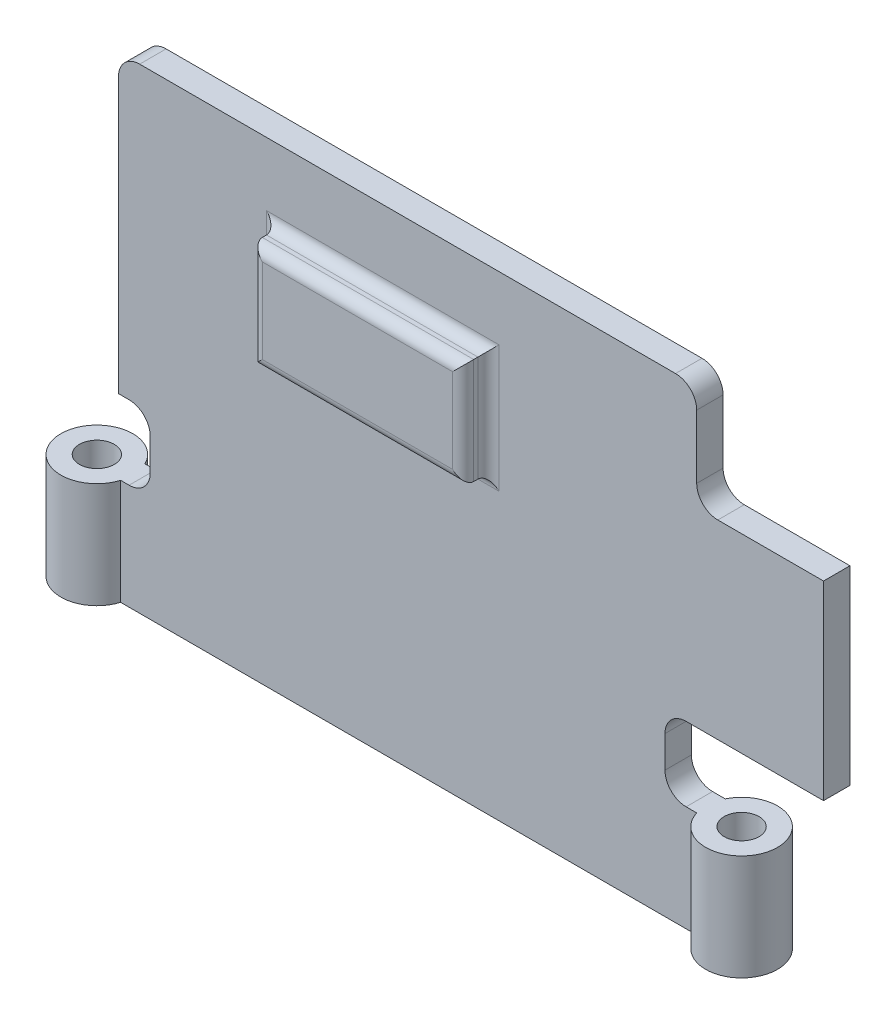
SolidWorks part; units mm, degrees
ref_plane "Plan de face" through (0, 0, 0) normal (0, 0, 1) x (1, 0, 0)
ref_plane "Plan de dessus" through (0, 0, 0) normal (0, 1, 0) x (1, 0, 0)
ref_plane "Plan de droite" through (0, 0, 0) normal (1, 0, 0) x (0, 0, -1)
sketch "Esquisse1" plane through (0, 0, 0) normal (0, 1, 0) x (1, 0, 0)
  line L0 (0, 0) -> (0, 1.5) construction
  line L1 (-27.4488, 1.5) -> (27.4488, 1.5)
  line L2 (-27.2504, -1) -> (27.2504, -1)
  circle A0 centre (-30.5, 0) radius 1.65
  circle A1 centre (30.5, 0) radius 1.65
  arc A2 (27.4488, 1.5) -> (27.2504, -1) centre (30.5, 0) cw
  arc A3 (-27.4488, 1.5) -> (-27.2504, -1) centre (-30.5, 0) ccw
  point P11 (0, 0)
  dimension "D1" = 3.3
  dimension "D2" = 3.4
  dimension "D4" = 3.4
  dimension "D3" = 61
  dimension "D5" = 1.5
  dimension "D6" = 1
extrude "Boss.-Extru.1" add sketch "Esquisse1" along normal blind 10
sketch "Esquisse2" plane through (0, 10, 0) normal (0, 1, 0) x (1, 0, 0)
  line L1 (-27.4488, 1.5) -> (27.2504, 1.5)
  line L2 (-27.4488, 1.5) -> (-27.4488, -1)
  line L3 (-27.4488, -1) -> (27.2504, -1)
  line L4 (27.2504, 1.5) -> (27.2504, -1)
extrude "Boss.-Extru.2" add sketch "Esquisse2" along normal blind 35
sketch "Esquisse3" plane through (-27.4488, 0, 0) normal (-1, 0, 0) x (0, 0, 1)
  line L0 (1, 45) -> (1, 10) construction
  line L1 (-1.5, 10) -> (1, 10)
  line L2 (-1.5, 10) -> (-1.5, 17)
  line L3 (-1.5, 17) -> (1, 17)
  line L4 (1, 10) -> (1, 17)
  dimension "D1" = 7
extrude "Enlèv. mat.-Extru.1" cut sketch "Esquisse3" against normal blind 3
sketch "Esquisse4" plane through (27.2504, 0, 0) normal (1, 0, 0) x (0, 0, -1)
  line L0 (-1, 45) -> (-1, 10) construction
  line L1 (1.5, 10) -> (-1, 10)
  line L2 (1.5, 10) -> (1.5, 17)
  line L3 (1.5, 17) -> (-1, 17)
  line L4 (-1, 10) -> (-1, 17)
  dimension "D1" = 7
extrude "Enlèv. mat.-Extru.2" cut sketch "Esquisse4" against normal blind 3
sketch "Esquisse5" plane through (27.2504, 0, 0) normal (1, 0, 0) x (0, 0, -1)
  line L0 (1.5, 17) -> (-1, 17) construction
  line L1 (1.5, 17) -> (-1, 17)
  line L2 (1.5, 17) -> (1.5, 35)
  line L3 (1.5, 35) -> (-1, 35)
  line L4 (-1, 17) -> (-1, 35)
  line L5 (1.5, 45) -> (1.5, 17) construction
  line L6 (-1, 45) -> (-1, 17) construction
  dimension "D1" = 18
extrude "Boss.-Extru.3" add sketch "Esquisse5" along normal blind 12
sketch "Esquisse7" plane through (0, 0, 1) normal (0, 0, 1) x (1, 0, 0)
  line L0 (-27.2504, 0) -> (27.2504, 0) construction
  line L1 (7.5512, 28) -> (-12.4488, 28)
  line L2 (7.5512, 28) -> (7.5512, 38)
  line L3 (7.5512, 38) -> (-12.4488, 38)
  line L4 (-12.4488, 28) -> (-12.4488, 38)
  line L5 (-27.4488, 45) -> (-27.4488, 17) construction
  dimension "D1" = 20
  dimension "D2" = 10
  dimension "D3" = 28
  dimension "D4" = 15
extrude "Boss.-Extru.4" add sketch "Esquisse7" along normal blind 2.4
fillet "Congé1" radius 2 7 edges at (24.2504, 10, -0.25) (24.2504, 17, -0.25) (27.2504, 35, -0.25) (27.2504, 45, -0.25) (-27.4488, 45, -0.25) (-24.4488, 17, -0.25) (-24.4488, 10, -0.25)
fillet "Congé2" radius 1 8 edges at (-2.4488, 28, 3.4) (-12.4488, 33, 3.4) (-2.4488, 38, 3.4) (7.5512, 33, 3.4) (7.5512, 33, 1) (-2.4488, 28, 1) (-12.4488, 33, 1) (-2.4488, 38, 1)
sketch "Esquisse8" plane through (0, 0, -1.5) normal (0, 0, -1) x (-1, 0, 0)
  line L0 (-24.5, 21) -> (-24.5, 28)
  line L1 (-24.5, 28) -> (-5.5823, 28)
  line L2 (-5.5823, 28) -> (-5.5823, 26)
  line L3 (-5.5823, 26) -> (-22.5823, 26)
  line L4 (-22.5823, 26) -> (-22.5823, 21)
  line L5 (-22.5823, 21) -> (-24.5823, 21)
  line L7 (-27.4488, 0) -> (27.4488, 0) construction
  dimension "D1" = 5
  dimension "D2" = 2
  dimension "D3" = 2
  dimension "D4" = 17
  dimension "D5" = 4.35
  dimension "D6" = 26
extrude "Boss.-Extru.5" add sketch "Esquisse8" along normal blind 1 contours L5 L4 L3 L2 L1 L0
